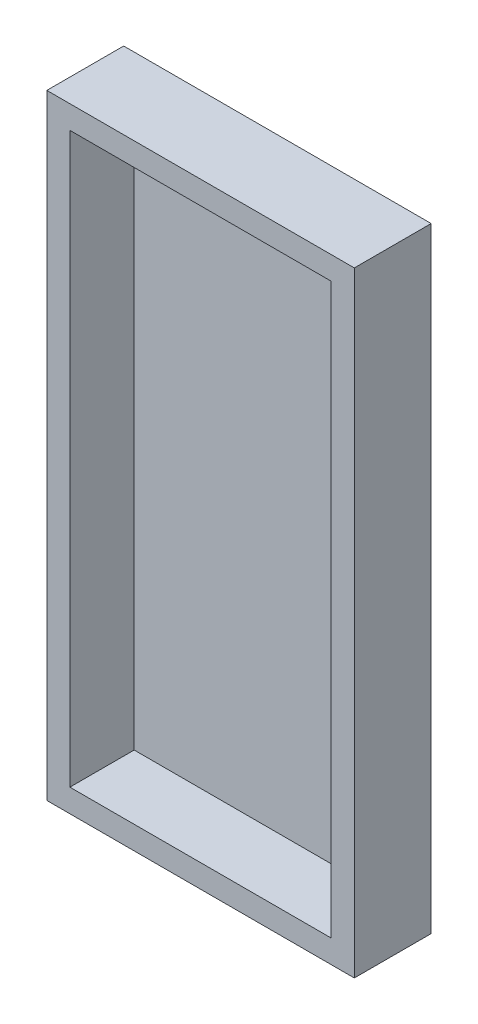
SolidWorks part; units mm, degrees
ref_plane "Alzado" through (0, 0, 0) normal (0, 0, 1) x (1, 0, 0)
ref_plane "Planta" through (0, 0, 0) normal (0, 1, 0) x (1, 0, 0)
ref_plane "Vista lateral" through (0, 0, 0) normal (1, 0, 0) x (0, 0, -1)
other "Gráfico1"
other "Gráfico (Abierta) -1"
other "Gráfico (Abierta) -2"
other "Gráfico (Abierta) -3"
other "Gráfico (Cerrada) -1"
other "Gráfico (Cerrada) -2"
other "Gráfico (Cerrada) -3"
other "Gráfico (Cerrada) -4"
other "Gráfico (Cerrada) -5"
other "Gráfico (Cerrada) -6"
other "Gráfico (Cerrada) -7"
other "Gráfico (Cerrada) -8"
other "Gráfico (Cerrada) -9"
other "Gráfico (Cerrada) -10"
sketch "Croquis1" plane through (0, 0, 0) normal (0, 0, 1) x (1, 0, 0)
  line L1 (20, -40) -> (-20, -40)
  line L2 (20, -40) -> (20, 40)
  line L3 (20, 40) -> (-20, 40)
  line L4 (-20, -40) -> (-20, 40)
  line L5 (20, -40) -> (-20, 40) construction
  line L6 (20, 40) -> (-20, -40) construction
  point P0 (0, 0)
  dimension "D1" = 40
  dimension "D2" = 80
extrude "Saliente-Extruir1" add sketch "Croquis1" along normal blind 8 and the other way blind 2
sketch "Croquis2" plane through (0, 0, 8) normal (0, 0, 1) x (1, 0, 0)
  line L0 (20, 40) -> (-20, 40) construction
  line L1 (17, -37) -> (-17, -37)
  line L2 (17, -37) -> (17, 37)
  line L3 (17, 37) -> (-17, 37)
  line L4 (-17, -37) -> (-17, 37)
  line L5 (17, -37) -> (-17, 37) construction
  line L6 (17, 37) -> (-17, -37) construction
  line L8 (20, -40) -> (20, 40) construction
  point P0 (0, 0)
  dimension "D1" = 3
  dimension "D2" = 3
extrude "Cortar-Extruir1" cut sketch "Croquis2" against normal blind 8.3632
